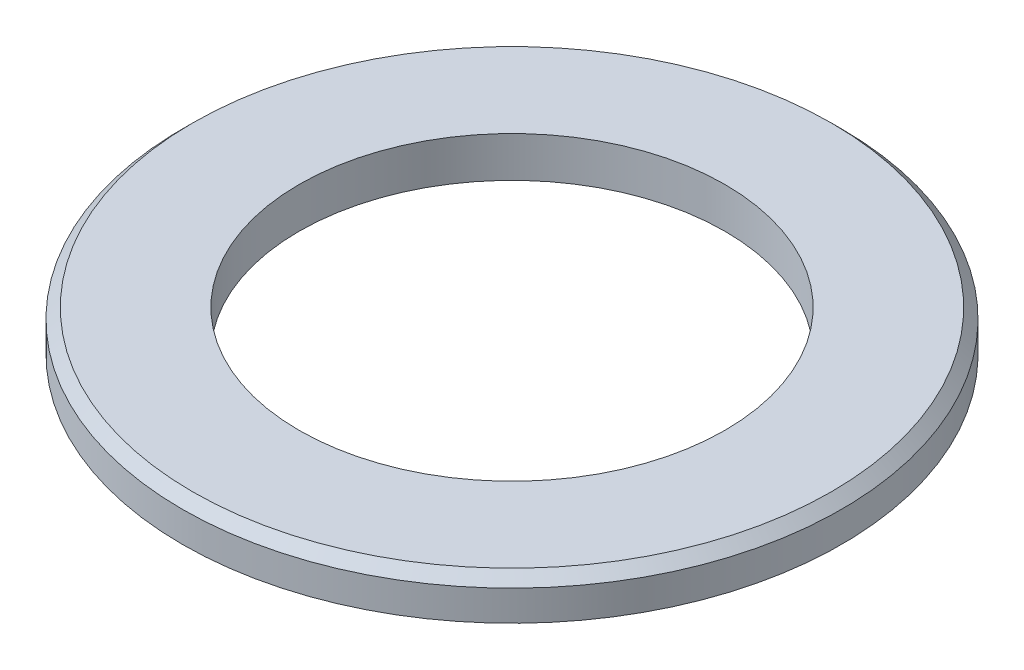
SolidWorks part; units mm, degrees
ref_plane "Face" through (0, 0, 0) normal (0, 0, 1) x (1, 0, 0)
ref_plane "Dessus" through (0, 0, 0) normal (0, 1, 0) x (1, 0, 0)
ref_plane "Droite" through (0, 0, 0) normal (1, 0, 0) x (0, 0, -1)
sketch "Esquisse1" plane through (0, 0, 0) normal (0, 1, 0) x (1, 0, 0)
  circle A0 centre (0, 0) radius 6.5
  circle A1 centre (0, 0) radius 4.2
  dimension "D2" = 13
  dimension "d1" = 8.4
extrude "Base-Extrusion" add sketch "Esquisse1" along normal blind 0.8
chamfer "Chanfrein3" distance 0.2 angle 45 1 edges at (0, 0.8, 6.5)
equation "\"D1@Chanfrein3\" = \"e@Base-Extrusion\"/4"
